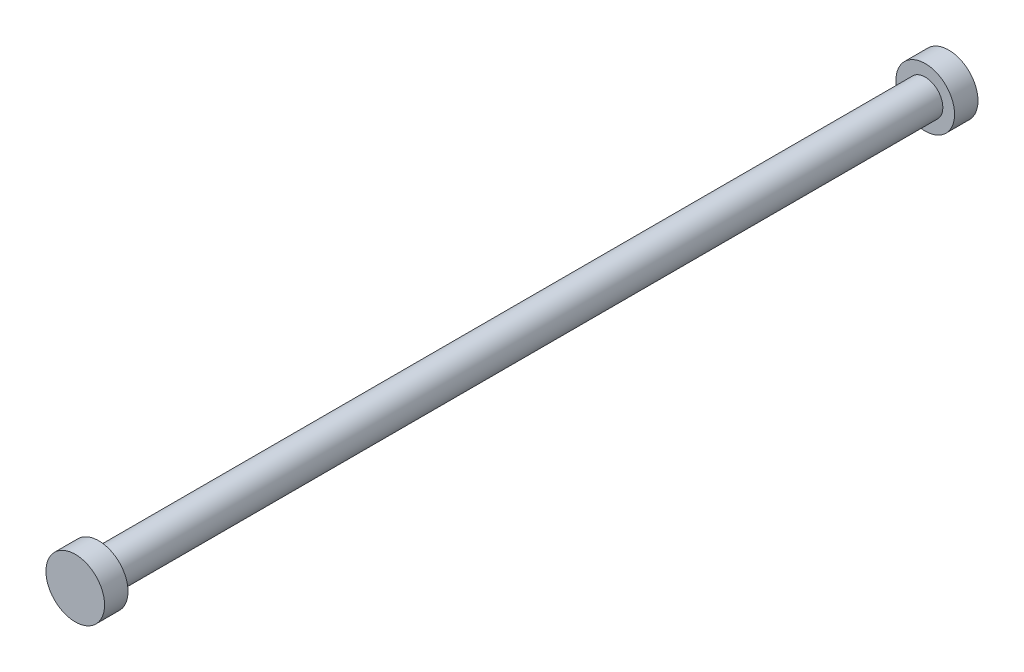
SolidWorks part; units mm, degrees
ref_plane "前视基准面" through (0, 0, 0) normal (0, 0, 1) x (1, 0, 0)
ref_plane "上视基准面" through (0, 0, 0) normal (0, 1, 0) x (1, 0, 0)
ref_plane "右视基准面" through (0, 0, 0) normal (1, 0, 0) x (0, 0, -1)
other "Configuration Table"
sketch "草图1" plane through (0, 0, 0) normal (0, 0, 1) x (1, 0, 0)
  circle A0 centre (0, 0) radius 10
  dimension "D1" = 20
extrude "Roller_Axle_Blank" add sketch "草图1" against normal mid plane 298
sketch "草图2" plane through (0, 0, 0) normal (0, 0, 1) x (1, 0, 0)
  circle A0 centre (0, 0) radius 12
  circle A1 centre (0, 0) radius 6
  dimension "D1" = 12
  dimension "D2" = 24
extrude "Axle_D12_Rollers_D20" cut sketch "草图2" against normal mid plane 282
